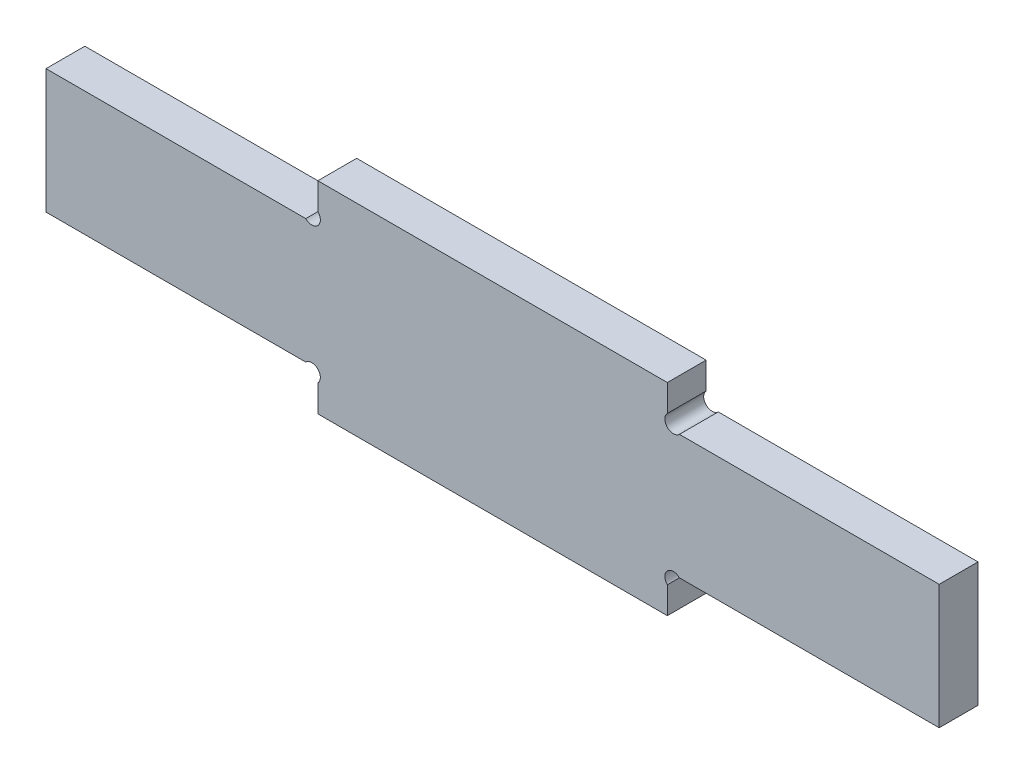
SolidWorks part; units mm, degrees
ref_plane "Plan de face" through (0, 0, 0) normal (0, 0, 1) x (1, 0, 0)
ref_plane "Plan de dessus" through (0, 0, 0) normal (0, 1, 0) x (1, 0, 0)
ref_plane "Plan de droite" through (0, 0, 0) normal (1, 0, 0) x (0, 0, -1)
sketch "Esquisse1" plane through (0, 0, 0) normal (0, 0, 1) x (1, 0, 0)
  line L1 (0, 0) -> (57.5, 0)
  line L2 (0, 0) -> (0, 26)
  line L3 (0, 26) -> (57.5, 26)
  line L4 (57.5, 0) -> (57.5, 26)
  dimension "D1" = 26
  dimension "D2" = 57.5
extrude "Boss.-Extru.1" add sketch "Esquisse1" along normal blind 5
sketch "Esquisse3" plane through (0, 0, 5) normal (0, 0, 1) x (1, 0, 0)
  line L1 (0, 26) -> (35, 26)
  line L2 (0, 26) -> (0, 21)
  line L3 (0, 21) -> (35, 21)
  line L4 (35, 26) -> (35, 21)
  line L5 (0, 0) -> (35, 0)
  line L6 (0, 0) -> (0, 5)
  line L7 (0, 5) -> (35, 5)
  line L8 (35, 0) -> (35, 5)
  dimension "D1" = 5
  dimension "D2" = 5
  dimension "D3" = 35
  dimension "D4" = 35
extrude "Enlèv. mat.-Extru.1" cut sketch "Esquisse3" against normal up to next
sketch "Esquisse4" plane through (0, 0, 5) normal (0, 0, 1) x (1, 0, 0)
  line L0 (35, 21) -> (28.6231, 27.3769) construction
  line L1 (35, 5) -> (29.6888, -0.3112) construction
  line L2 (0, 21) -> (35, 21) construction
  line L3 (35, 5) -> (0, 5) construction
  circle A0 centre (34.2222, 21.7778) radius 1.1
  circle A1 centre (34.2222, 4.2222) radius 1.1
  dimension "D3" = 2.2
  dimension "D4" = 2.2
  dimension "D1" = 45
  dimension "D2" = 45
extrude "Enlèv. mat.-Extru.2" cut sketch "Esquisse4" against normal up to next
mirror "Symétrie1" about plane through (57.5, 0, 5) normal (-1, 0, 0) of "Enlèv. mat.-Extru.2", "Enlèv. mat.-Extru.1", "Boss.-Extru.1"
